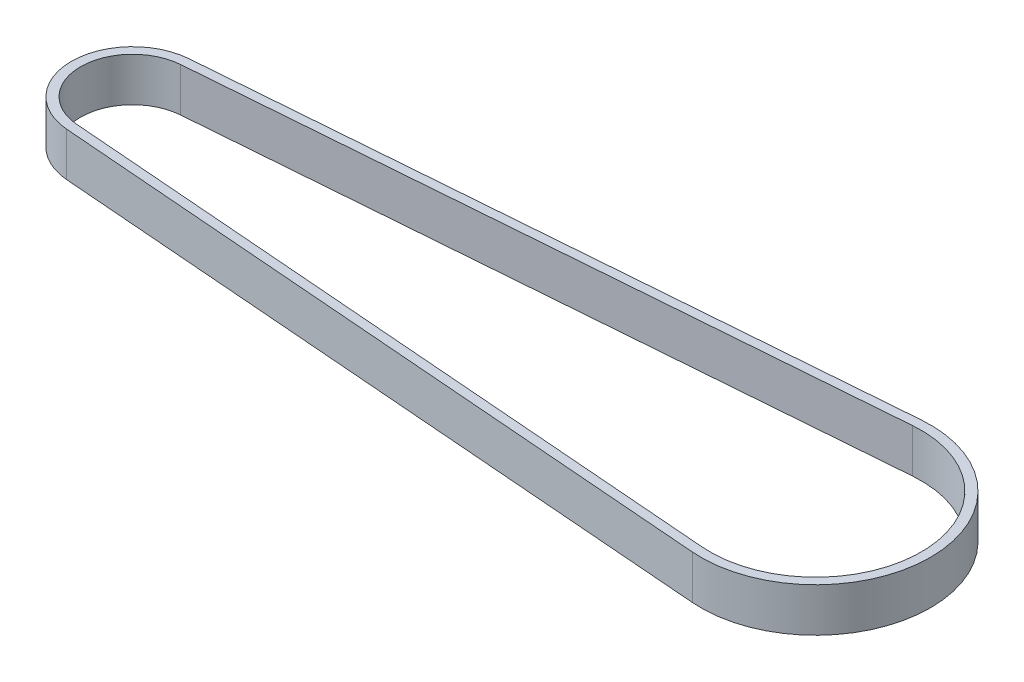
SolidWorks part; units mm, degrees
ref_plane "Front Plane" through (0, 0, 0) normal (0, 0, 1) x (1, 0, 0)
ref_plane "Top Plane" through (0, 0, 0) normal (0, 1, 0) x (1, 0, 0)
ref_plane "Right Plane" through (0, 0, 0) normal (1, 0, 0) x (0, 0, -1)
sketch "Sketch1" plane through (0, 0, 0) normal (0, 1, 0) x (1, 0, 0)
  line L0 (-1.6452, 20.9413) -> (231.1391, 39.2291)
  line L1 (-1.6452, -20.9413) -> (231.1391, -39.2291)
  line L2 (-1.3965, 17.776) -> (231.3878, 36.0639)
  line L3 (-1.3965, -17.776) -> (231.3878, -36.0639)
  arc A0 (-1.6452, 20.9413) -> (-1.6452, -20.9413) centre (0, 0) ccw
  arc A1 (231.1391, -39.2291) -> (231.1391, 39.2291) centre (234.221, 0) ccw
  arc A2 (231.3878, -36.0639) -> (231.3878, 36.0639) centre (234.221, 0) ccw
  arc A3 (-1.3965, 17.776) -> (-1.3965, -17.776) centre (0, 0) ccw
  dimension "D2" = 42.0116
  dimension "D3" = 78.7
  dimension "D1" = 234.221
  dimension "D4" = 3.175
extrude "Boss-Extrude1" add sketch "Sketch1" along normal blind 15
